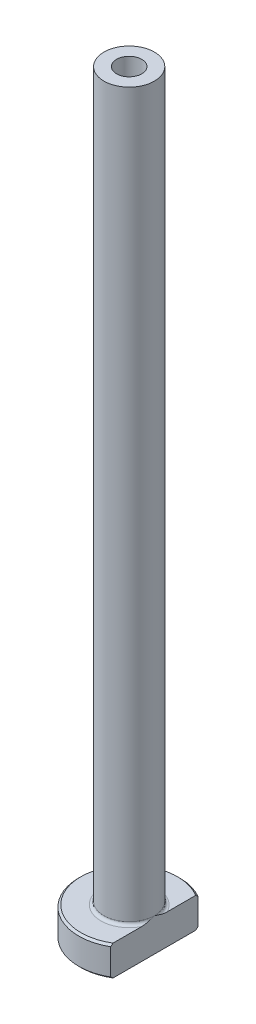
SolidWorks part; units mm, degrees
ref_plane "Front Plane" through (0, 0, 0) normal (0, 0, 1) x (1, 0, 0)
ref_plane "Top Plane" through (0, 0, 0) normal (0, 1, 0) x (1, 0, 0)
ref_plane "Right Plane" through (0, 0, 0) normal (1, 0, 0) x (0, 0, -1)
sketch "Sketch1" plane through (0, 0, 0) normal (0, 0, 1) x (1, 0, 0)
  line L0 (-1.25, 75) -> (-2.5, 75)
  line L1 (-2.5, 75) -> (-2.5, 3)
  line L2 (-2.5, 3) -> (-5, 3)
  line L3 (-5, 3) -> (-5, 0)
  line L4 (4.125, 0) -> (-4.125, 0) construction
  line L5 (-5, 0) -> (-1.5, 0)
  line L6 (-1.25, 40) -> (-1.25, 75)
  line L7 (0, 92.1877) -> (0, -15.5353) construction
  line L8 (0, -5.5) -> (0, 5.5) construction
  line L9 (-1.25, 40) -> (-1.5, 28)
  line L10 (-1.5, 28) -> (-1.5, 0)
  dimension "D1" = 0.25
  dimension "ID" = 2.5
  dimension "OD" = 5
  dimension "L" = 75
  dimension "H" = 10
  dimension "T" = 3
  dimension "N" = 35
  dimension "D2" = 12
  dimension "L-N" = 40
revolve "Revolve1" add sketch "Sketch1" angle 360 about L7
fillet "Fillet1" radius 0.3 1 edges at (0, 3, 2.5)
chamfer "Chamfer1" distance 0.2 angle 45 2 edges at (0, 3, 5) (0, 0, 5)
sketch "Sketch2" plane through (0, 0, 0) normal (0, -1, 0) x (1, 0, 0)
  line L0 (2.5, 4.3301) -> (2.5, -4.3301)
  circle A0 centre (0, 0) radius 5 construction
  arc A1 (2.5, 4.3301) -> (2.5, -4.3301) centre (0, 0) cw
  circle A2 centre (0, 0) radius 2.5 construction
extrude "Cut-Extrude1" cut sketch "Sketch2" against normal through all
chamfer "Chamfer2" distance 0.5 angle 45 1 edges at (0, 0, 1.5)
